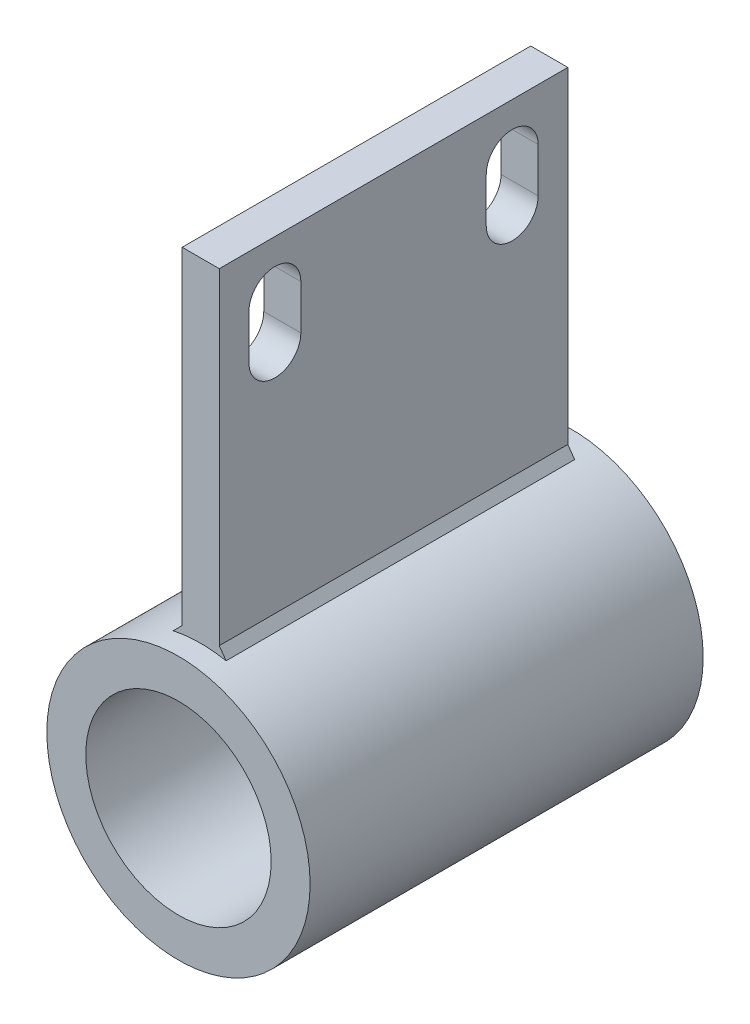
SolidWorks part; units mm, degrees
ref_plane "Face" through (0, 0, 0) normal (0, 0, 1) x (1, 0, 0)
ref_plane "Dessus" through (0, 0, 0) normal (0, 1, 0) x (1, 0, 0)
ref_plane "Droite" through (0, 0, 0) normal (1, 0, 0) x (0, 0, -1)
sketch "Esquisse1" plane through (0, 0, 0) normal (0, 0, 1) x (1, 0, 0)
  line L0 (5, 125.5) -> (5, 35.1461)
  line L1 (-5, 125.5) -> (5, 125.5)
  line L6 (-5, 125.5) -> (-5, 35.1461)
  arc A0 (-5, 35.1461) -> (5, 35.1461) centre (0, 0) ccw
  circle A1 centre (0, 0) radius 25
  point P1 (0, 0)
  dimension "D5" = 71
  dimension "D6" = 50
  dimension "D8" = 5
extrude "Base-Extrusion" add sketch "Esquisse1" along normal blind 106
sketch "Esquisse2" plane through (0, 0, 106) normal (0, 0, 1) x (1, 0, 0)
  line L0 (5, 125.5) -> (-5, 125.5) construction
  line L1 (-5, 125.5) -> (5, 125.5)
  line L2 (-5, 125.5) -> (-5, 35.1461)
  line L4 (5, 125.5) -> (5, 35.1461)
  arc A0 (5, 35.1461) -> (-5, 35.1461) centre (0, 0) ccw
  dimension "D1" = 71
  dimension "D2" = 5
extrude "Enlèv. mat.-Extru.1" cut sketch "Esquisse2" against normal blind 6
sketch "Esquisse3" plane through (0, 0, 0) normal (0, 0, -1) x (-1, 0, 0)
  line L0 (-5, 125.5) -> (5, 125.5) construction
  line L1 (-5, 125.5) -> (5, 125.5)
  line L2 (-5, 125.5) -> (-5, 35.1461)
  line L4 (5, 125.5) -> (5, 35.1461)
  arc A0 (5, 35.1461) -> (-5, 35.1461) centre (0, 0) ccw
  dimension "D1" = 71
  dimension "D2" = 5
extrude "Enlèv. mat.-Extru.2" cut sketch "Esquisse3" against normal blind 6
sketch "Esquisse4" plane through (-5, 0, 0) normal (-1, 0, 0) x (0, 0, 1)
  line L0 (95.1559, 105.5) -> (56.5586, 105.5) construction
  line L1 (34.112, 105.5) -> (12.7603, 105.5) construction
  line L2 (100, 125.5) -> (6, 125.5) construction
  line L3 (100, 125.5) -> (100, 35.1461) construction
  line L6 (92, 111.5) -> (92, 99.5)
  line L7 (14, 111.5) -> (14, 99.5)
  line L9 (78, 111.5) -> (78, 99.5)
  line L10 (28, 111.5) -> (28, 99.5)
  arc A0 (28, 111.5) -> (14, 111.5) centre (21, 111.5) ccw
  arc A1 (14, 99.5) -> (28, 99.5) centre (21, 99.5) ccw
  arc A2 (92, 111.5) -> (78, 111.5) centre (85, 111.5) ccw
  arc A3 (78, 99.5) -> (92, 99.5) centre (85, 99.5) ccw
  dimension "D1" = 14
  dimension "D2" = 14
  dimension "D3" = 14
  dimension "D4" = 14
  dimension "D5" = 12
  dimension "D6" = 12
  dimension "D7" = 20
  dimension "D8" = 20
  dimension "D9" = 15
  dimension "D10" = 64
extrude "Enlèv. mat.-Extru.3" cut sketch "Esquisse4" against normal through all
chamfer "Chanfrein1" distance 2 angle 45
